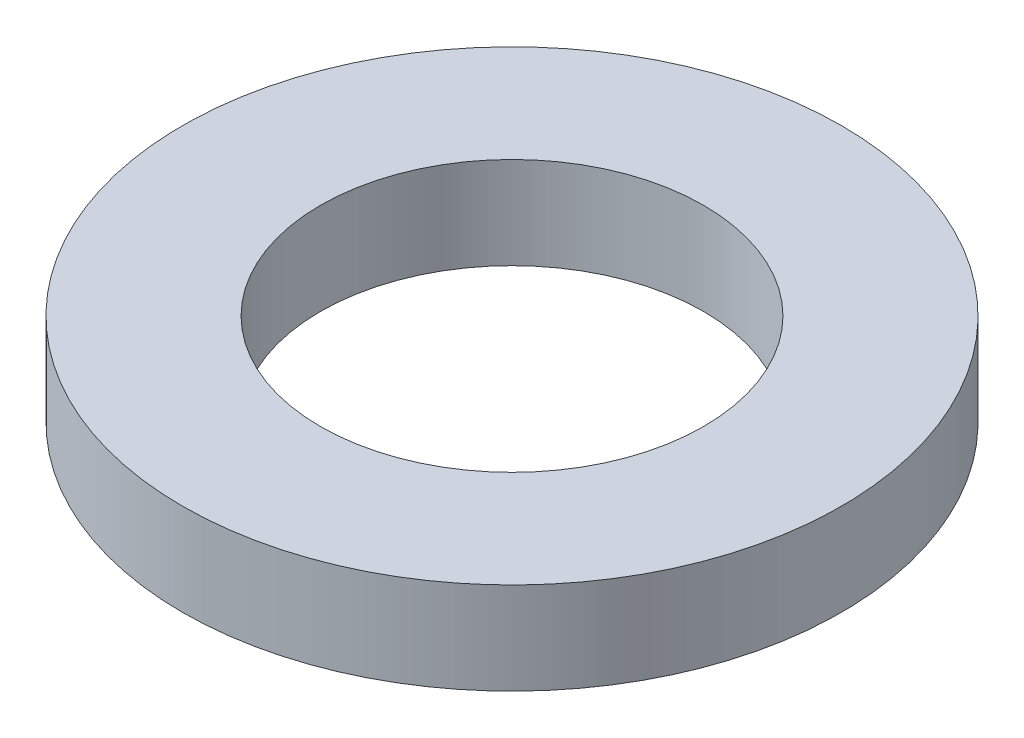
SolidWorks part; units mm, degrees
ref_plane "Plan de face" through (0, 0, 0) normal (0, 0, 1) x (1, 0, 0)
ref_plane "Plan de dessus" through (0, 0, 0) normal (0, 1, 0) x (1, 0, 0)
ref_plane "Plan de droite" through (0, 0, 0) normal (1, 0, 0) x (0, 0, -1)
sketch "Esquisse1" plane through (0, 0, 0) normal (0, 1, 0) x (1, 0, 0)
  circle A0 centre (0, 0) radius 43
  circle A1 centre (0, 0) radius 25
  dimension "D1" = 86
  dimension "D2" = 50
extrude "Extrusion1" add sketch "Esquisse1" along normal blind 12
